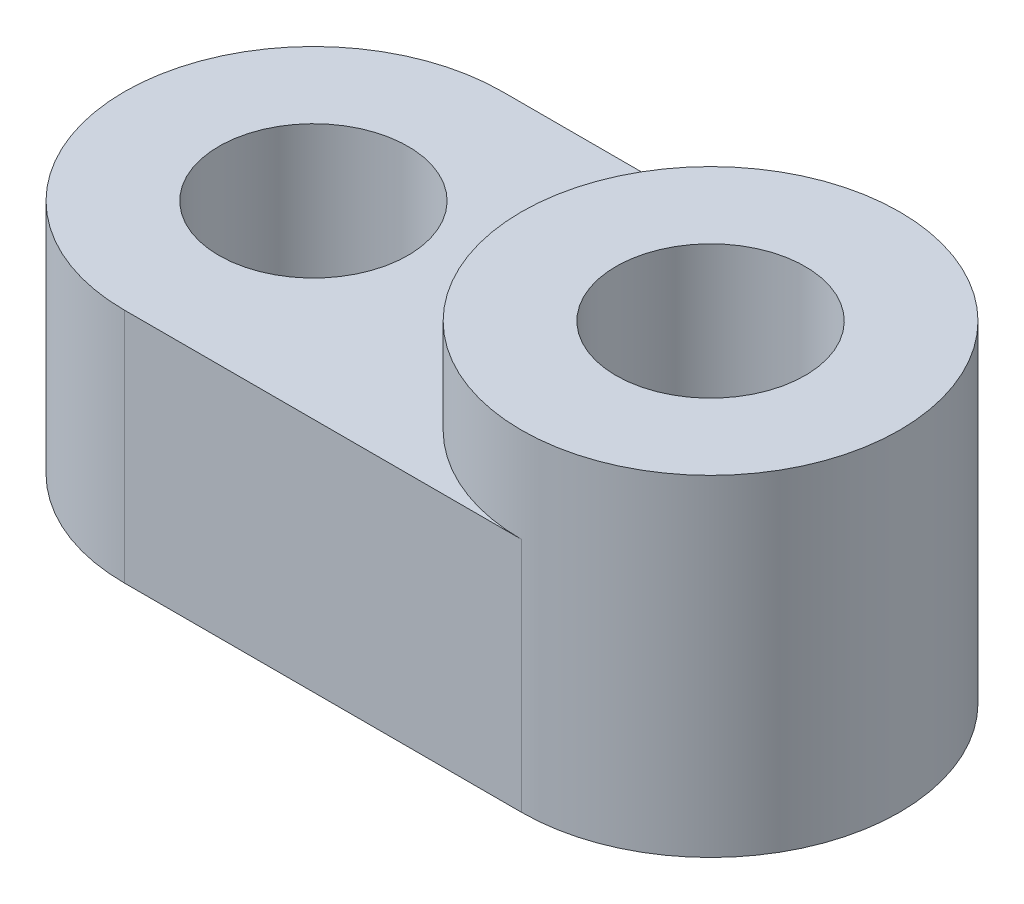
SolidWorks part; units mm, degrees
ref_plane "前视基准面" through (0, 0, 0) normal (0, 0, 1) x (1, 0, 0)
ref_plane "上视基准面" through (0, 0, 0) normal (0, 1, 0) x (1, 0, 0)
ref_plane "右视基准面" through (0, 0, 0) normal (1, 0, 0) x (0, 0, -1)
sketch "草图1" plane through (0, 0, 0) normal (0, 1, 0) x (1, 0, 0)
  line L0 (0, 0) -> (8.4, 0) construction
  line L1 (0, 4) -> (8.4, 4)
  line L2 (0, -4) -> (8.4, -4)
  circle A0 centre (0, 0) radius 2
  circle A1 centre (8.4, 0) radius 2
  arc A2 (0, 4) -> (0, -4) centre (0, 0) ccw
  arc A3 (8.4, -4) -> (8.4, 4) centre (8.4, 0) ccw
  point P5 (4.2, 0)
  dimension "D1" = 4
  dimension "D3" = 4
  dimension "D2" = 8.4
extrude "凸台-拉伸1" add sketch "草图1" along normal blind 5
sketch "草图2" plane through (0, 5, 0) normal (0, 1, 0) x (1, 0, 0)
  circle A0 centre (8.4, 0) radius 4
  circle A2 centre (8.4, 0) radius 2
  dimension "D1" = 4
extrude "凸台-拉伸2" add sketch "草图2" along normal blind 2
